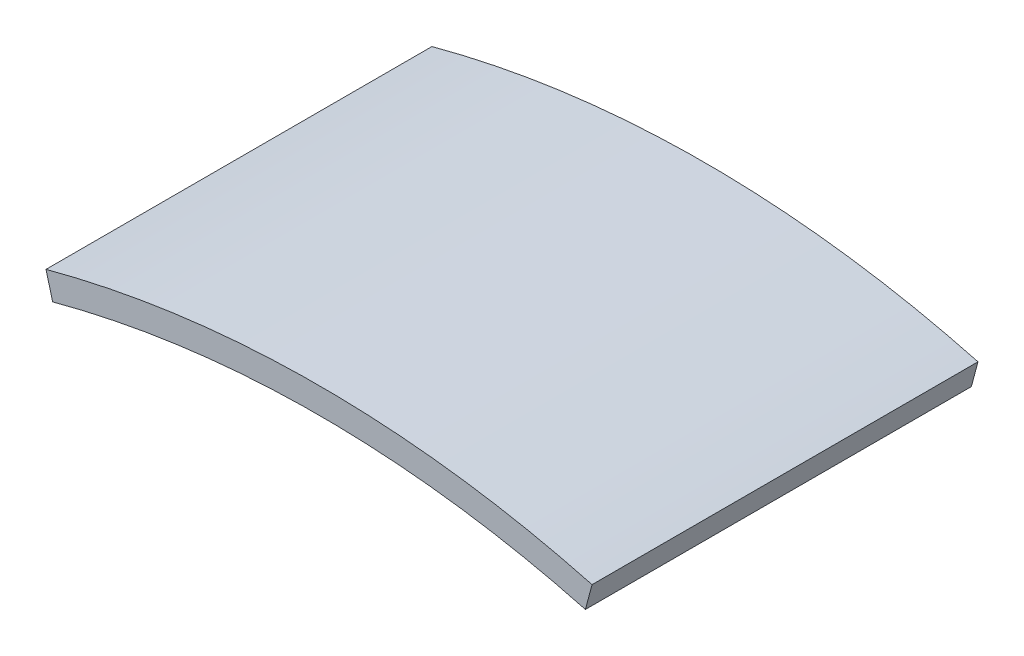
SolidWorks part; units mm, degrees
ref_plane "Front Plane" through (0, 0, 0) normal (0, 0, 1) x (1, 0, 0)
ref_plane "Top Plane" through (0, 0, 0) normal (0, 1, 0) x (1, 0, 0)
ref_plane "Right Plane" through (0, 0, 0) normal (1, 0, 0) x (0, 0, -1)
sketch "Sketch1" plane through (0, 0, 0) normal (0, 0, 1) x (1, 0, 0)
  line L1 (50.3528, 38.637) -> (50.6116, 39.603)
  line L4 (29.6472, 38.637) -> (29.3884, 39.603)
  line L5 (-0.9878, -1) -> (80.9878, -1) construction
  line L6 (0, 0) -> (80, 0) construction
  arc A0 (29.6472, 38.637) -> (50.3528, 38.637) centre (40, 0) cw
  arc A1 (29.3884, 39.603) -> (50.6116, 39.603) centre (40, 0) cw
  arc A3 (-0.9878, -1) -> (80.9878, -1) centre (40, 0) cw construction
  arc A4 (0, 0) -> (80, 0) centre (40, 0) cw construction
  dimension "D1" = 40
  dimension "D3" = 38.637
  dimension "D4" = 21.2232
  dimension "D2" = 1
extrude "Extrude1" add sketch "Sketch1" along normal blind 15
ref_plane "Plane1" through (0, 40, 0) normal (0, 1, 0) x (-1, 0, 0)
sketch "Sketch2" plane through (0, 40, 0) normal (0, 1, 0) x (-1, 0, 0)
  line L0 (-50.3528, 15) -> (-50.3528, 0) construction
  line L2 (-29.6472, 15) -> (-50.3528, 15) construction
  circle A0 centre (-40.0028, 7.5) radius 2.5
  dimension "D1" = 5
  dimension "D2" = 10.35
  dimension "D3" = 7.5
extrude "Extrude3" cut sketch "Sketch2" against normal blind 0.1
